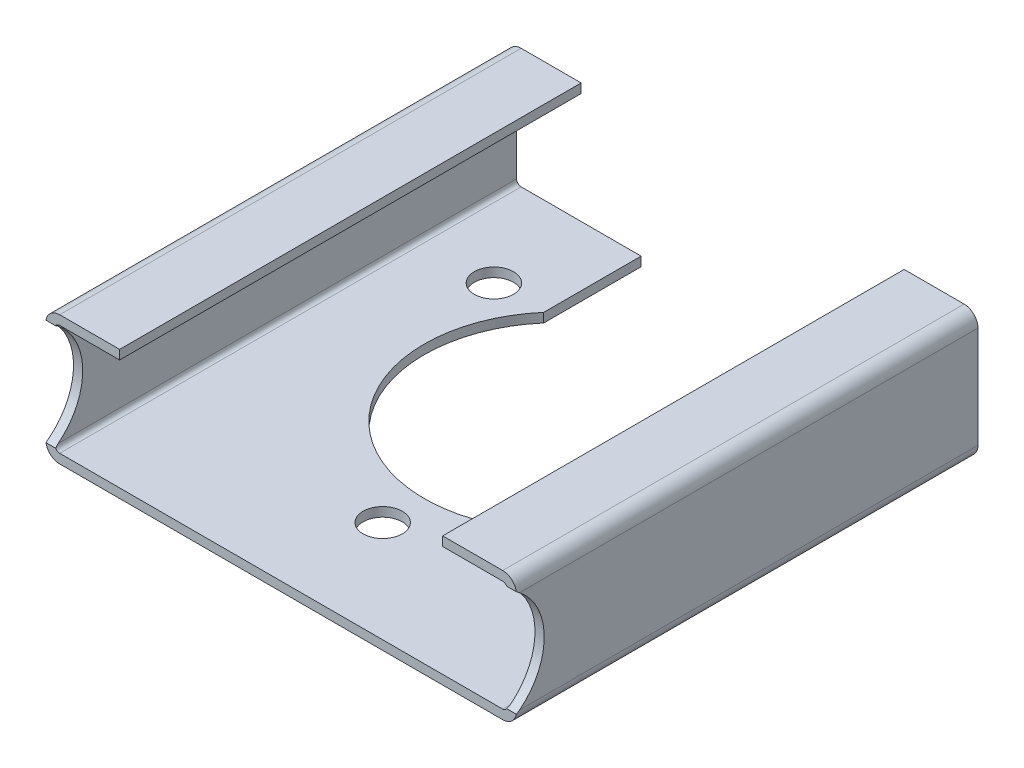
SolidWorks part; units mm, degrees
ref_plane "Plan1" through (0, 0, 0) normal (0, 0, 1) x (1, 0, 0)
ref_plane "Plan2" through (0, 0, 0) normal (0, 1, 0) x (1, 0, 0)
ref_plane "Plan3" through (0, 0, 0) normal (1, 0, 0) x (0, 0, -1)
sketch "Esquisse1" plane through (0, 0, 0) normal (0, 0, 1) x (1, 0, 0)
  line L0 (2, 3) -> (2, 25)
  line L1 (3, 0) -> (99, 0)
  line L2 (0, 3) -> (0, 25)
  line L3 (3, 28) -> (16, 28)
  line L4 (102, 3) -> (102, 25)
  line L5 (3, 26) -> (16, 26)
  line L6 (100, 3) -> (100, 25)
  line L7 (3, 2) -> (99, 2)
  line L8 (16, 28) -> (16, 26)
  line L9 (86, 28) -> (86, 26)
  line L10 (86, 28) -> (99, 28)
  line L11 (86, 26) -> (99, 26)
  arc A0 (3, 26) -> (2, 25) centre (3, 25) ccw
  arc A1 (3, 2) -> (2, 3) centre (3, 3) cw
  arc A2 (100, 3) -> (99, 2) centre (99, 3) cw
  arc A3 (100, 25) -> (99, 26) centre (99, 25) ccw
  arc A4 (3, 28) -> (0, 25) centre (3, 25) ccw
  arc A5 (3, 0) -> (0, 3) centre (3, 3) cw
  arc A6 (102, 3) -> (99, 0) centre (99, 3) cw
  arc A7 (99, 28) -> (102, 25) centre (99, 25) cw
  point P23 (0, 28)
  point P26 (0, 0)
  point P29 (102, 0)
  point P32 (102, 28)
  dimension "D5" = 1
  dimension "D6" = 3
  dimension "D1" = 28
  dimension "D2" = 102
  dimension "D4" = 16
  dimension "D3" = 2
extrude "Base-Extrusion" add sketch "Esquisse1" against normal blind 100
sketch "Esquisse2" plane through (102, 0, 0) normal (1, 0, 0) x (0, 0, -1)
  line L0 (100, 14) -> (-11, 14) construction
  line L1 (100, 3) -> (100, 25) construction
  line L2 (0, 3) -> (0, 25) construction
  circle A0 centre (-8, 14) radius 14
  dimension "D1" = 28
  dimension "D2" = 8
extrude "Enlèv. mat.-Extru.1" cut sketch "Esquisse2" against normal through all
sketch "Esquisse3" plane through (0, 0, 0) normal (0, -1, 0) x (1, 0, 0)
  line L0 (51, -60) -> (51, -100) construction
  line L1 (3, -100) -> (99, -100) construction
  line L2 (3, 0) -> (99, 0) construction
  line L3 (29, -100) -> (73, -100)
  line L4 (29, -78.8944) -> (29, -100)
  line L5 (73, -78.8944) -> (73, -100)
  line L6 (51, -60) -> (87.5896, -81.125) construction
  line L7 (51, -60) -> (14.4104, -81.125) construction
  line L8 (51, -60) -> (51, -17.75) construction
  arc A0 (73, -78.8944) -> (29, -78.8944) centre (51, -60) ccw
  circle A1 centre (51, -22) radius 4.25
  circle A2 centre (83.909, -79) radius 4.25
  circle A3 centre (18.091, -79) radius 4.25
  dimension "D2" = 58
  dimension "D6" = 8.5
  dimension "D1" = 60
  dimension "D3" = 44
  dimension "D4" = 38
  dimension "D5" = 60
  dimension "D7" = 60
extrude "Enlèv. mat.-Extru.2" cut sketch "Esquisse3" against normal up to next
